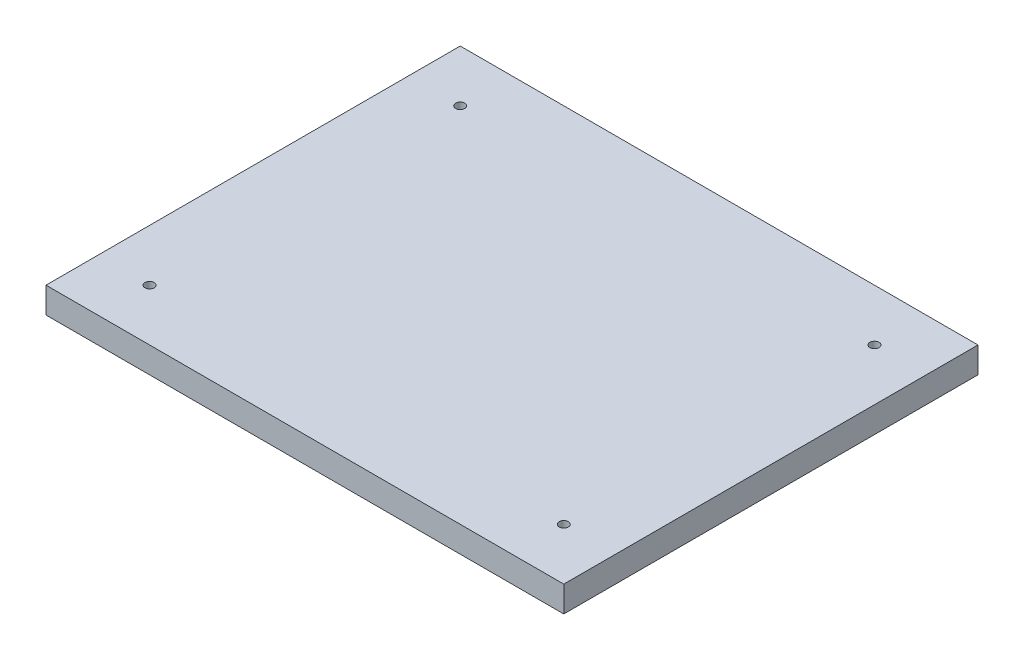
SolidWorks part; units mm, degrees
ref_plane "Front Plane" through (0, 0, 0) normal (0, 0, 1) x (1, 0, 0)
ref_plane "Top Plane" through (0, 0, 0) normal (0, 1, 0) x (1, 0, 0)
ref_plane "Right Plane" through (0, 0, 0) normal (1, 0, 0) x (0, 0, -1)
sketch "Sketch1" plane through (0, 0, 0) normal (0, 1, 0) x (1, 0, 0)
  line L1 (-32.5941, 28.8751) -> (94.4059, 28.8751)
  line L2 (-32.5941, 28.8751) -> (-32.5941, -72.7249)
  line L3 (-32.5941, -72.7249) -> (94.4059, -72.7249)
  line L4 (94.4059, 28.8751) -> (94.4059, -72.7249)
  dimension "D1" = 101.6
  dimension "D2" = 127
extrude "Extrude1" add sketch "Sketch1" along normal blind 6.35
hole_wizard "#4-40 Tapped Hole1" positions "Sketch3" profile "Sketch2" tap size "#4-40" standard "Ansi Inch"
sketch "Sketch3" plane through (0, 6.35, 0) normal (0, 1, 0) x (-1, 0, 0)
  line L0 (32.5941, -28.8751) -> (32.5941, 72.7249) construction
  line L1 (32.5941, 72.7249) -> (-94.4059, 72.7249) construction
  line L3 (-94.4059, -28.8751) -> (32.5941, -28.8751) construction
  line L4 (-94.4059, 72.7249) -> (-94.4059, -28.8751) construction
  point P0 (19.8941, 60.0249)
  point P1 (19.8941, -16.1751)
  point P3 (-81.7059, -16.1751)
  point P5 (-81.7059, 60.0249)
  dimension "D1" = 12.7
  dimension "D2" = 12.7
  dimension "D3" = 12.7
  dimension "D4" = 12.7
  dimension "D5" = 12.7
  dimension "D6" = 12.7
  dimension "D7" = 12.7
  dimension "D8" = 12.7
sketch "Sketch2" plane through (-19.8941, 6.35, 60.0249) normal (1, 0, 0) x (0, 0, 1)
  line L0 (0, 0) -> (0, 8.2992)
  line L1 (0, 8.2992) -> (1.1303, 7.62)
  line L2 (1.1303, 7.62) -> (1.1303, 0)
  line L5 (1.1303, 0) -> (0, 0)
  line L10 (0, 8.2992) -> (-1.1303, 7.62) construction
  line L11 (0, -6.35) -> (0, 107.95) construction
  dimension "Tap Drill Dia." = 2.2606
  dimension "Tap Drill Depth" = 7.62
  dimension "Drill Angle" = 118
